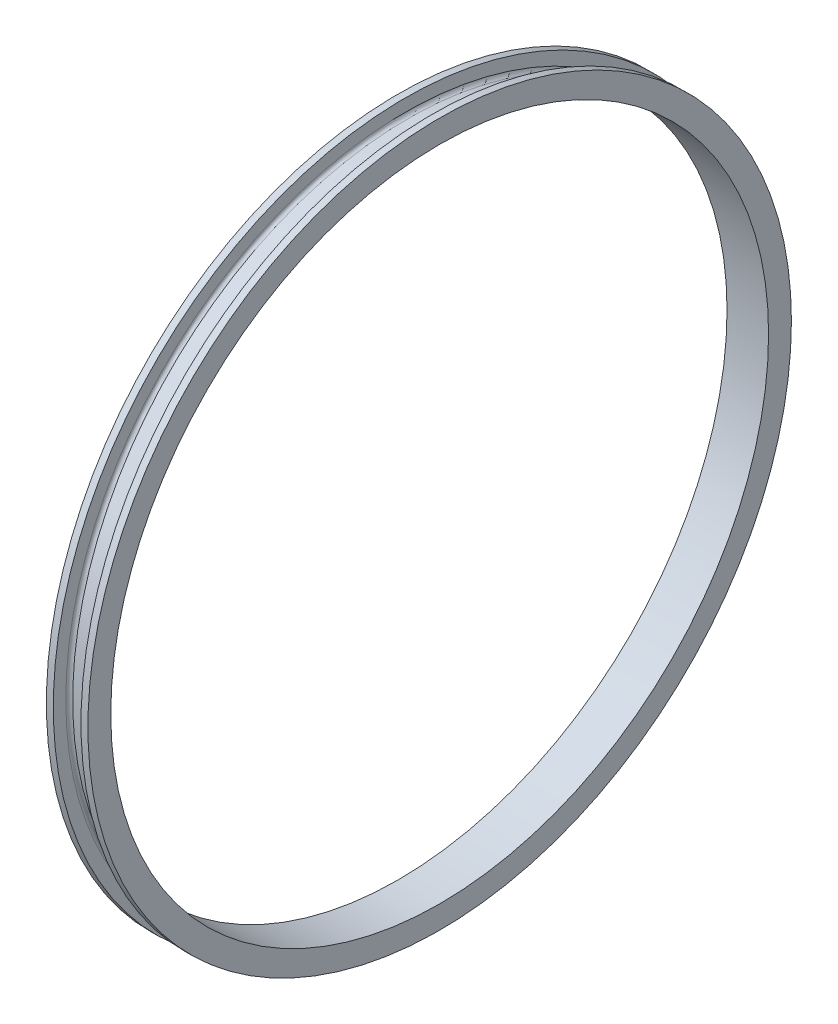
SolidWorks part; units mm, degrees
ref_plane "Face" through (0, 0, 0) normal (0, 0, 1) x (1, 0, 0)
ref_plane "Cote" through (0, 0, 0) normal (0, 1, 0) x (1, 0, 0)
ref_plane "Dessus" through (0, 0, 0) normal (1, 0, 0) x (0, 0, -1)
sketch "Esquisse1" plane through (0, 0, 0) normal (0, 0, 1) x (1, 0, 0)
  line L0 (0, 0) -> (-88.4182, 0) construction
  line L1 (-75.817, 50.8) -> (-75.817, 47.5)
  line L2 (-75.817, 47.5) -> (-69.817, 47.5)
  line L3 (-69.817, 47.5) -> (-69.817, 50.8)
  line L4 (-69.817, 50.8) -> (-70.817, 50.8)
  line L5 (-70.817, 50.8) -> (-70.817, 49)
  line L6 (-71.317, 48.5) -> (-74.317, 48.5)
  line L7 (-74.817, 49) -> (-74.817, 50.8)
  line L8 (-74.817, 50.8) -> (-75.817, 50.8)
  arc A0 (-70.817, 49) -> (-71.317, 48.5) centre (-71.317, 49) cw
  arc A1 (-74.817, 49) -> (-74.317, 48.5) centre (-74.317, 49) ccw
  dimension "R" = 0.5
  dimension "Ø B" = 101.6
  dimension "Ø Fh8" = 97
  dimension "Ø A" = 95
  dimension "E" = 1
  dimension "C" = 6
revolve "Base-Révolution" add sketch "Esquisse1" angle 360 about L0
